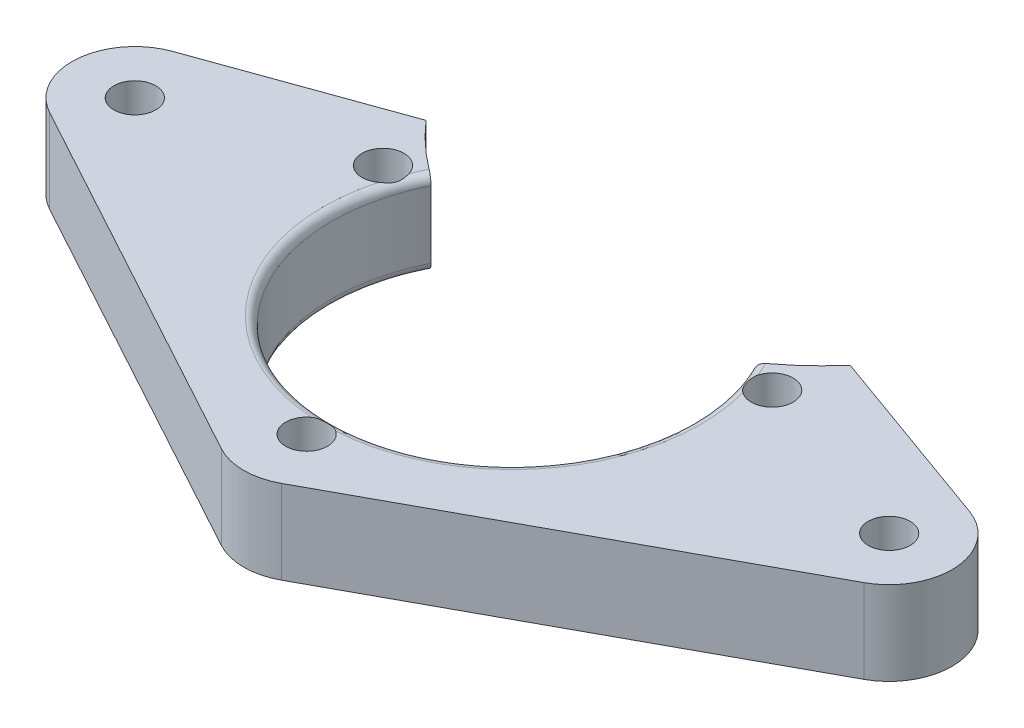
SolidWorks part; units mm, degrees
ref_plane "前视基准面" through (0, 0, 0) normal (0, 0, 1) x (1, 0, 0)
ref_plane "上视基准面" through (0, 0, 0) normal (0, 1, 0) x (1, 0, 0)
ref_plane "右视基准面" through (0, 0, 0) normal (1, 0, 0) x (0, 0, -1)
sketch "草图1" plane through (0, 0, 0) normal (0, 1, 0) x (1, 0, 0)
  circle A0 centre (0, 0) radius 100
  dimension "D1" = 200
extrude "凸台-拉伸1" add sketch "草图1" along normal blind 10
sketch "草图2" plane through (0, 10, 0) normal (0, 1, 0) x (1, 0, 0)
  circle A1 centre (-23.2162, 7.8268) radius 2.5
  circle A2 centre (23.2162, 7.8268) radius 2.5
  circle A3 centre (0, -24.5) radius 2.5
  dimension "D1" = 24.5
  dimension "D2" = 5
  dimension "D3" = 5
  dimension "D4" = 5
  dimension "D5" = 24.5
  dimension "D6" = 24.5
extrude "切除-拉伸1" cut sketch "草图2" against normal through all
sketch "草图6" plane through (0, 10, 0) normal (0, 1, 0) x (1, 0, 0)
  circle A0 centre (0, 0) radius 22
  circle A1 centre (0, 37.1) radius 15
  dimension "D1" = 30
  dimension "D2" = 37.1
sketch "草图7" plane through (0, 10, 0) normal (0, 1, 0) x (1, 0, 0)
  circle A0 centre (-45, 0) radius 2.5
  circle A1 centre (45, 0) radius 2.5
  dimension "D3" = 5
  dimension "D4" = 5
  dimension "D1" = 45
  dimension "D2" = 45
extrude "切除-拉伸2" cut sketch "草图7" against normal blind 10
sketch "草图11" plane through (0, 10, 0) normal (0, 1, 0) x (1, 0, 0)
  circle A0 centre (0, 0) radius 21.5
  dimension "D1" = 43
sketch "草图12" plane through (0, 10, 0) normal (0, 1, 0) x (1, 0, 0)
  line L0 (-47.536, 7.0582) -> (-25.7522, 14.8851)
  line L1 (-48.5863, -6.587) -> (-3.5863, -31.087)
  line L2 (47.536, 7.0582) -> (25.7522, 14.8851)
  line L3 (48.5863, -6.587) -> (3.5863, -31.087)
  line L5 (-25.7522, 14.8851) -> (-25.3038, 15.0462)
  line L6 (25.7522, 14.8851) -> (25.3038, 15.0462)
  circle A2 centre (-45, 0) radius 7.5
  arc A3 (-47.536, 7.0582) -> (-48.5863, -6.587) centre (-45, 0) ccw
  circle A5 centre (45, 0) radius 7.5
  arc A6 (48.5863, -6.587) -> (47.536, 7.0582) centre (45, 0) ccw
  circle A8 centre (0, -24.5) radius 7.5
  arc A9 (-3.5863, -31.087) -> (3.5863, -31.087) centre (0, -24.5) ccw
  arc A13 (-25.3038, 15.0462) -> (-19.2472, 9.5811) centre (0, 37) ccw
  circle A14 centre (0, 0) radius 100
  circle A17 centre (0, 0) radius 100
  arc A18 (19.2472, 9.5811) -> (-19.2472, 9.5811) centre (0, 0) ccw
  arc A19 (19.2472, 9.5811) -> (25.3038, 15.0462) centre (0, 37) ccw
  dimension "D4" = 37
  dimension "D5" = 67
  dimension "D6" = 43
  dimension "D1" = 5
  dimension "D2" = 5
  dimension "D3" = 5
extrude "切除-拉伸5" cut sketch "草图12" against normal through all
extrude "切除-拉伸6" cut sketch "草图11" against normal blind 10 contours A0
fillet "圆角1" radius 1 1 edges at (0, 0, 21.5)
fillet "圆角2" radius 1 1 edges at (0, 10, 21.5)
